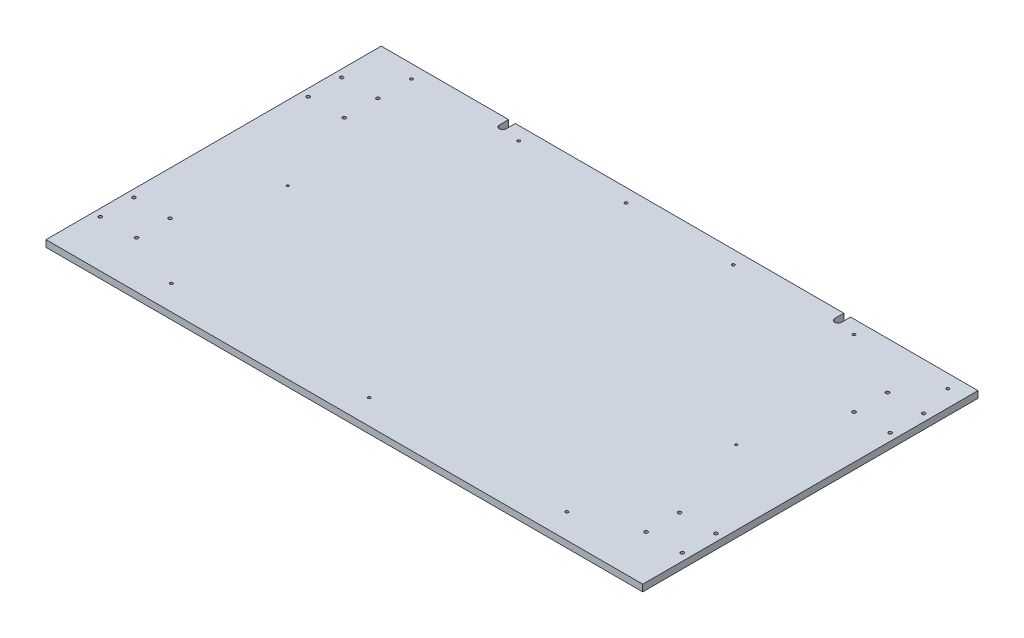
SolidWorks part; units mm, degrees
ref_plane "Спереди" through (0, 0, 0) normal (0, 0, 1) x (1, 0, 0)
ref_plane "Сверху" through (0, 0, 0) normal (0, 1, 0) x (1, 0, 0)
ref_plane "Справа" through (0, 0, 0) normal (1, 0, 0) x (0, 0, -1)
sketch "Эскиз1" plane through (0, 0, 0) normal (0, 1, 0) x (1, 0, 0)
  line L1 (445, 250) -> (-445, 250)
  line L2 (445, 250) -> (445, -250)
  line L3 (445, -250) -> (-445, -250)
  line L4 (-445, 250) -> (-445, -250)
  line L5 (445, 250) -> (-445, -250) construction
  line L6 (445, -250) -> (-445, 250) construction
  point P0 (0, 0)
  dimension "D1" = 890
  dimension "D2" = 500
extrude "Бобышка-Вытянуть1" add sketch "Эскиз1" along normal blind 10
hole_wizard "Отверстие для линейн. подшип." positions "Эскиз21" profile "Эскиз22" tap size "M6" standard "ISO"
sketch "Эскиз21" plane through (0, 10, 0) normal (0, 1, 0) x (1, 0, 0)
  line L0 (445, 250) -> (-445, 250) construction
  line L1 (-445, 250) -> (-445, -250) construction
  point P0 (-434, 180)
  point P2 (-380, 180)
  point P4 (-380, 130)
  point P6 (-434, 130)
  point P27 (-434, -130)
  point P28 (-380, -130)
  point P29 (-380, -180)
  point P30 (-434, -180)
  point P31 (434, -180)
  point P32 (380, -180)
  point P33 (380, -130)
  point P34 (434, -130)
  point P35 (434, 130)
  point P36 (380, 130)
  point P37 (380, 180)
  point P38 (434, 180)
  dimension "D1" = 54
  dimension "D2" = 50
  dimension "D3" = 70
  dimension "D4" = 11
sketch "Эскиз22" plane through (-434, 10, -180) normal (1, 0, 0) x (0, 0, 1)
  line L0 (0, 0) -> (0, 10)
  line L1 (0, 10) -> (2.5, 10)
  line L2 (2.5, 10) -> (2.5, 0)
  line L5 (2.5, 0) -> (0, 0)
  line L11 (0, -6.35) -> (0, 107.95) construction
  dimension "Диаметр проходного сверла" = 5
  dimension "Глубина проходного сверла" = 10
hole_wizard "Отверстие для роликов" positions "Эскиз23" profile "Эскиз24" tap size "M5" standard "ISO"
sketch "Эскиз23" plane through (0, 10, 0) normal (0, 1, 0) x (1, 0, 0)
  line L2 (445, -250) -> (445, 250) construction
  line L3 (445, 250) -> (-445, 250) construction
  line L4 (-445, 250) -> (-445, -250) construction
  line L5 (-445, -250) -> (445, -250) construction
  point P9 (-60, 230)
  point P11 (100, 230)
  point P13 (280, 230)
  point P15 (420, 230)
  point P17 (295, -213)
  point P21 (0, -213)
  point P37 (-220, 230)
  point P39 (-295, -213)
  point P50 (-380, 230)
  dimension "D1" = 20
  dimension "D2" = 150
  dimension "D3" = 590
  dimension "D4" = 25
  dimension "D5" = 150
  dimension "D6" = 140
  dimension "D7" = 160
  dimension "D8" = 160
  dimension "D10" = 37
  dimension "D11" = 295
  dimension "D12" = 160
sketch "Эскиз24" plane through (-60, 10, -230) normal (1, 0, 0) x (0, 0, 1)
  line L0 (0, 0) -> (0, 10)
  line L1 (0, 10) -> (2.1, 10)
  line L2 (2.1, 10) -> (2.1, 0)
  line L5 (2.1, 0) -> (0, 0)
  line L11 (0, -6.35) -> (0, 107.95) construction
  dimension "Диаметр проходного сверла" = 4.2
  dimension "Глубина проходного сверла" = 10
hole_wizard "Отверстие для пружин" positions "Эскиз25" profile "Эскиз26" tap size "M4" standard "ISO"
sketch "Эскиз25" plane through (0, 0, 250) normal (0, 0, 1) x (1, 0, 0)
  line L0 (445, 10) -> (445, 0) construction
  line L1 (-445, 10) -> (445, 10) construction
  line L2 (-445, 10) -> (-445, 0) construction
  point P0 (-355, 5)
  point P2 (-145, 5)
  point P4 (145, 5)
  point P6 (355, 5)
  point P12 (445, 5)
  dimension "D1" = 5
  dimension "D2" = 90
  dimension "D3" = 210
  dimension "D4" = 290
  dimension "D5" = 210
  dimension "D6" = 90
sketch "Эскиз26" plane through (-355, 5, 250) normal (1, 0, 0) x (0, -1, 0)
  line L0 (0, 0) -> (0, 12.4914)
  line L1 (0, 12.4914) -> (1.65, 11.5)
  line L2 (1.65, 11.5) -> (1.65, 0)
  line L5 (1.65, 0) -> (0, 0)
  line L10 (0, 12.4914) -> (-1.65, 11.5) construction
  line L11 (0, -6.35) -> (0, 107.95) construction
  dimension "Диаметр сверла" = 3.3
  dimension "Глубина сверла" = 11.5
  dimension "Угол заточки сверла" = 118
hole_wizard "Отверстие для  ремня" positions "Эскиз27" profile "Эскиз28" tap size "M4" standard "ISO"
sketch "Эскиз27" plane through (0, 10, 0) normal (0, 1, 0) x (1, 0, 0)
  line L0 (-445, 250) -> (-445, -250) construction
  line L1 (445, -250) -> (445, 250) construction
  line L2 (-445, -250) -> (445, -250) construction
  point P0 (-334.5, 0)
  point P2 (334.5, 0)
  dimension "D1" = 110.5
  dimension "D2" = 110.5
  dimension "D3" = 250
sketch "Эскиз28" plane through (-334.5, 10, 0) normal (1, 0, 0) x (0, 0, 1)
  line L0 (0, 0) -> (0, 10)
  line L1 (0, 10) -> (1.65, 10)
  line L2 (1.65, 10) -> (1.65, 0)
  line L5 (1.65, 0) -> (0, 0)
  line L11 (0, -6.35) -> (0, 107.95) construction
  dimension "Диаметр проходного сверла" = 3.3
  dimension "Глубина проходного сверла" = 10
hole_wizard "отв. под напр. штифты для фольги" positions "Эскиз29" profile "Эскиз30" size "Ø10.0" standard "ISO"
sketch "Эскиз29" plane through (0, 0, 492.5) normal (0, -1, 0) x (-1, 0, 0)
  line L0 (250, 723.7) -> (250, 747.7) construction
  point P0 (250, 735.7)
  point P4 (-250, 735.7)
sketch "Эскиз30" plane through (-250, 0, -243.2) normal (1, 0, 0) x (0, 0, -1)
  line L0 (0, 0) -> (0, 13.0043)
  line L1 (0, 13.0043) -> (5, 10)
  line L2 (5, 10) -> (5, 0)
  line L3 (5, 0) -> (0, 0)
  line L4 (0, 13.0043) -> (-5, 10) construction
  line L5 (0, -6.35) -> (0, 107.95) construction
  dimension "Диаметр отверстия" = 10
  dimension "Глубина отверстия" = 10
  dimension "Угол заточки сверла" = 118
